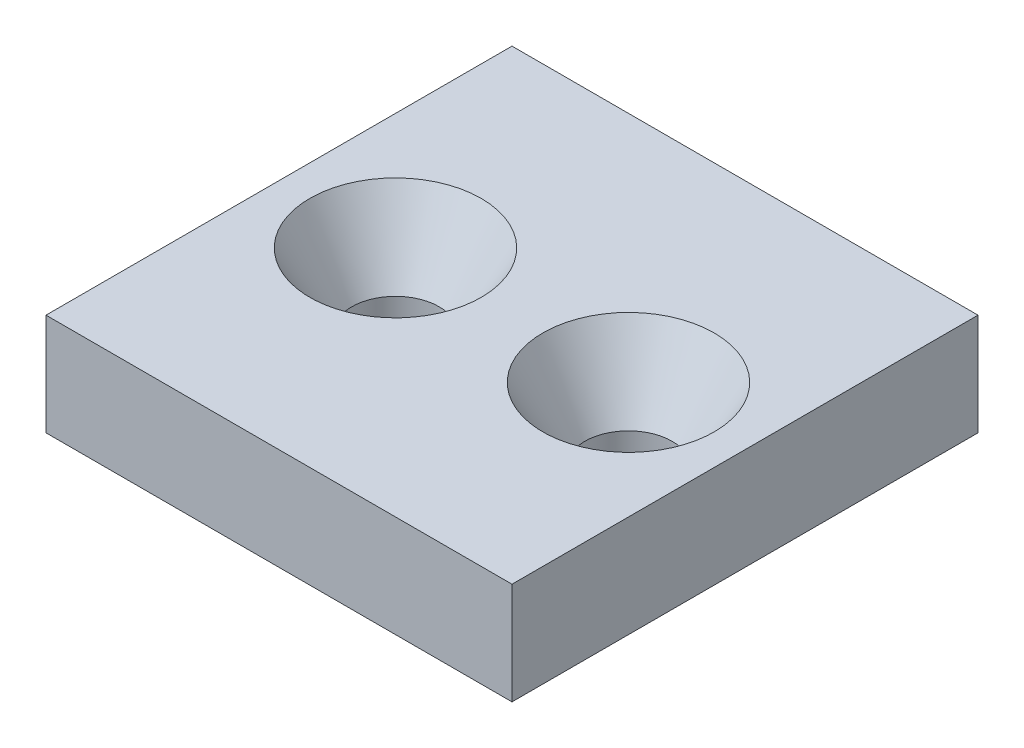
SolidWorks part; units mm, degrees
ref_plane "Front Plane" through (0, 0, 0) normal (0, 0, 1) x (1, 0, 0)
ref_plane "Top Plane" through (0, 0, 0) normal (0, 1, 0) x (1, 0, 0)
ref_plane "Right Plane" through (0, 0, 0) normal (1, 0, 0) x (0, 0, -1)
sketch "Sketch2" plane through (0, 0, 0) normal (0, 1, 0) x (1, 0, 0)
  line L1 (-16, -16) -> (16, -16)
  line L2 (-16, -16) -> (-16, 16)
  line L3 (-16, 16) -> (16, 16)
  line L4 (16, -16) -> (16, 16)
  line L5 (-16, -16) -> (16, 16) construction
  line L6 (-16, 16) -> (16, -16) construction
  point P0 (0, 0)
  dimension "D1" = 32
extrude "Extrude1" add sketch "Sketch2" along normal blind 7
sketch "Sketch4" plane through (0, 0, 0) normal (0, 0, 1) x (1, 0, 0)
  line L0 (-8, 0) -> (-8, 10.665) construction
  line L1 (-16, 0) -> (16, 0) construction
  line L2 (-16, 7) -> (16, 7) construction
  line L3 (-11, 0) -> (-11, 2)
  line L4 (-11, 2) -> (-13.8868, 7)
  line L5 (-11, 0) -> (-8, 0)
  line L6 (-8, 7) -> (-8, 0)
  line L7 (-8, 7) -> (-13.8868, 7)
  line L8 (-2.1132, 7) -> (-5, 2) construction
  dimension "D1" = 6
  dimension "D2" = 5
  dimension "D3" = 60
  dimension "D4" = 8
revolve "D7 V60 Hole" cut sketch "Sketch4" angle 360 about L0
mirror "Mirror1" about plane through (0, 0, 0) normal (1, 0, 0) of "D7 V60 Hole"
